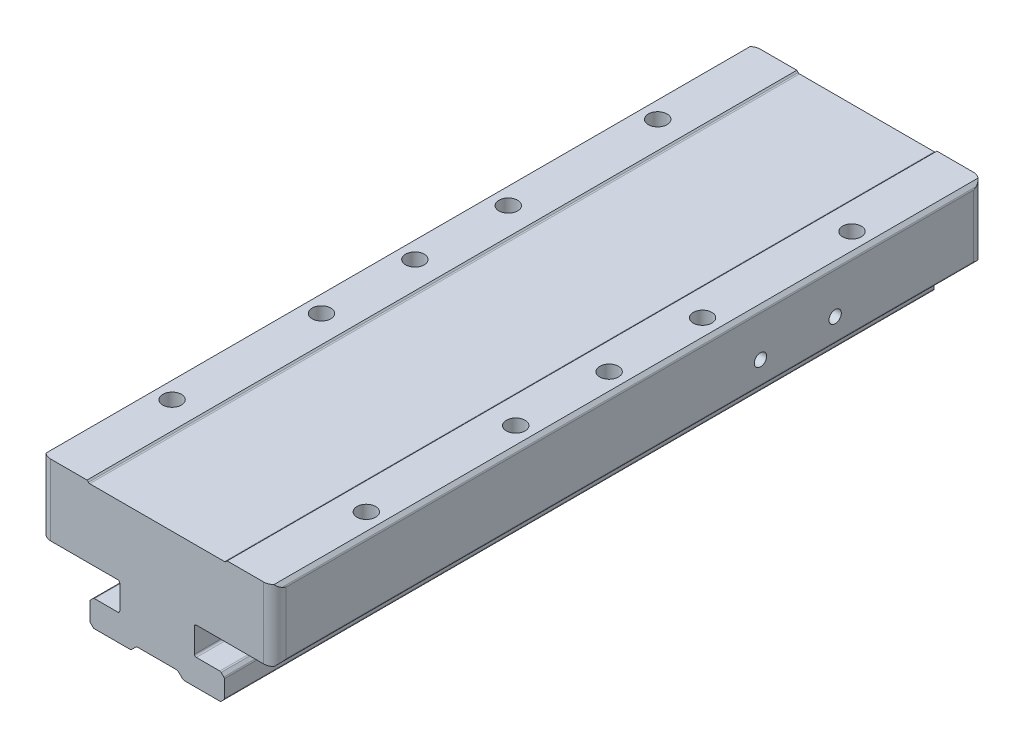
SolidWorks part; units mm, degrees
ref_plane "前视基准面" through (0, 0, 0) normal (0, 0, 1) x (1, 0, 0)
ref_plane "上视基准面" through (0, 0, 0) normal (0, 1, 0) x (1, 0, 0)
ref_plane "右视基准面" through (0, 0, 0) normal (1, 0, 0) x (0, 0, -1)
sketch "草图1" plane through (0, 0, 0) normal (0, 0, 1) x (1, 0, 0)
  line L4 (18.0429, 31.5) -> (-18.0429, 31.5)
  line L5 (-18.3964, 31.6464) -> (-19.6036, 32.8536)
  line L6 (-19.9571, 33) -> (-29.2929, 33)
  line L7 (-29.6464, 32.8536) -> (-31.3536, 31.1464)
  line L8 (-31.5, 30.7929) -> (-31.5, 14.2071)
  line L9 (-31.3536, 13.8536) -> (-30.6464, 13.1464)
  line L10 (-30.2929, 13) -> (-10.5, 13)
  line L11 (-10, 12.5) -> (-10, 6)
  line L12 (-10.5, 5.5) -> (-16.7929, 5.5)
  line L13 (-17.1464, 5.3536) -> (-17.8536, 4.6464)
  line L14 (-18, 4.2929) -> (-18, -0.2929)
  line L15 (-17.8536, -0.6464) -> (-17.1464, -1.3536)
  line L16 (-16.7929, -1.5) -> (-7.4142, -1.5)
  line L17 (-6.7071, -1.2071) -> (-5.7929, -0.2929)
  line L18 (-5.0858, 0) -> (5.0858, 0)
  line L19 (5.7929, -0.2929) -> (6.7071, -1.2071)
  line L20 (7.4142, -1.5) -> (16.7929, -1.5)
  line L21 (17.1464, -1.3536) -> (17.8536, -0.6464)
  line L22 (18, -0.2929) -> (18, 4.2929)
  line L23 (17.8536, 4.6464) -> (17.1464, 5.3536)
  line L24 (16.7929, 5.5) -> (10.5, 5.5)
  line L25 (10, 6) -> (10, 12.5)
  line L26 (10.5, 13) -> (30.2929, 13)
  line L27 (30.6464, 13.1464) -> (31.3536, 13.8536)
  line L28 (31.5, 14.2071) -> (31.5, 30.7929)
  line L29 (31.3536, 31.1464) -> (29.6464, 32.8536)
  line L30 (29.2929, 33) -> (19.9571, 33)
  line L31 (19.6036, 32.8536) -> (18.3964, 31.6464)
  arc A4 (-18.3964, 31.6464) -> (-18.0429, 31.5) centre (-18.0429, 32) ccw
  arc A5 (-19.6036, 32.8536) -> (-19.9571, 33) centre (-19.9571, 32.5) ccw
  arc A6 (-29.2929, 33) -> (-29.6464, 32.8536) centre (-29.2929, 32.5) ccw
  arc A7 (-31.3536, 31.1464) -> (-31.5, 30.7929) centre (-31, 30.7929) ccw
  arc A8 (-31.5, 14.2071) -> (-31.3536, 13.8536) centre (-31, 14.2071) ccw
  arc A9 (-30.6464, 13.1464) -> (-30.2929, 13) centre (-30.2929, 13.5) ccw
  arc A10 (-10, 12.5) -> (-10.5, 13) centre (-10.5, 12.5) ccw
  arc A11 (-10.5, 5.5) -> (-10, 6) centre (-10.5, 6) ccw
  arc A12 (-16.7929, 5.5) -> (-17.1464, 5.3536) centre (-16.7929, 5) ccw
  arc A13 (-17.8536, 4.6464) -> (-18, 4.2929) centre (-17.5, 4.2929) ccw
  arc A14 (-18, -0.2929) -> (-17.8536, -0.6464) centre (-17.5, -0.2929) ccw
  arc A15 (-17.1464, -1.3536) -> (-16.7929, -1.5) centre (-16.7929, -1) ccw
  arc A16 (-7.4142, -1.5) -> (-6.7071, -1.2071) centre (-7.4142, -0.5) ccw
  arc A17 (-5.0858, 0) -> (-5.7929, -0.2929) centre (-5.0858, -1) ccw
  arc A18 (5.7929, -0.2929) -> (5.0858, 0) centre (5.0858, -1) ccw
  arc A19 (6.7071, -1.2071) -> (7.4142, -1.5) centre (7.4142, -0.5) ccw
  arc A20 (16.7929, -1.5) -> (17.1464, -1.3536) centre (16.7929, -1) ccw
  arc A21 (17.8536, -0.6464) -> (18, -0.2929) centre (17.5, -0.2929) ccw
  arc A22 (18, 4.2929) -> (17.8536, 4.6464) centre (17.5, 4.2929) ccw
  arc A23 (17.1464, 5.3536) -> (16.7929, 5.5) centre (16.7929, 5) ccw
  arc A24 (10, 6) -> (10.5, 5.5) centre (10.5, 6) ccw
  arc A25 (10.5, 13) -> (10, 12.5) centre (10.5, 12.5) ccw
  arc A26 (30.2929, 13) -> (30.6464, 13.1464) centre (30.2929, 13.5) ccw
  arc A27 (31.3536, 13.8536) -> (31.5, 14.2071) centre (31, 14.2071) ccw
  arc A28 (31.5, 30.7929) -> (31.3536, 31.1464) centre (31, 30.7929) ccw
  arc A29 (29.6464, 32.8536) -> (29.2929, 33) centre (29.2929, 32.5) ccw
  arc A30 (19.9571, 33) -> (19.6036, 32.8536) centre (19.9571, 32.5) ccw
  arc A31 (18.0429, 31.5) -> (18.3964, 31.6464) centre (18.0429, 32) ccw
  point P99 (31.5, 29.0363)
  point P100 (-31.5, 29.0363)
  dimension "D1" = 63
extrude "凸台-拉伸1" add sketch "草图1" along normal blind 190
sketch "草图3" plane through (0, 0, 0) normal (0, 0, -1) x (-1, 0, 0)
  line L1 (0, 0) -> (0, 48.184) construction
  line L6 (-29.2929, 33) -> (-19.9571, 33) construction
  line L7 (-50, 33) -> (50, 33)
  line L8 (-50, 33) -> (-50, 32)
  line L9 (-50, 32) -> (50, 32)
  line L10 (50, 33) -> (50, 32)
  dimension "D1" = 100
  dimension "D3" = 1
extrude "切除-拉伸1" cut sketch "草图3" against normal through all
ref_plane "基准面1" through (0, 0, 95) normal (0, 0, -1) x (-1, 0, 0)
hole_wizard "M6 螺纹孔1" positions "草图43" profile "草图44" tap size "M6" standard "GB"
sketch "草图43" plane through (0, 32, 0) normal (0, 1, 0) x (1, 0, 0)
  line L0 (0, 0) -> (0, -208.4222) construction
  line L2 (31.5, -95) -> (-56.5631, -95) construction
  line L4 (17.875, -95) -> (-17.875, -95) construction
  line L5 (31.5, -190) -> (31.5, 0) construction
  point P0 (26, -70)
  point P2 (26, -120)
  point P4 (26, -160)
  point P6 (26, -30)
  point P23 (-26, -30)
  point P24 (-26, -160)
  point P25 (-26, -120)
  point P26 (-26, -70)
  dimension "D1" = 50
  dimension "D2" = 130
  dimension "D3" = 52
sketch "草图44" plane through (26, 32, 70) normal (1, 0, 0) x (0, 0, 1)
  line L0 (0, 0) -> (0, 16.5022)
  line L1 (0, 16.5022) -> (2.5, 15)
  line L2 (2.5, 15) -> (2.5, 0)
  line L5 (2.5, 0) -> (0, 0)
  line L10 (0, 16.5022) -> (-2.5, 15) construction
  line L11 (0, -6.35) -> (0, 107.95) construction
  dimension "螺纹孔钻头直径" = 5
  dimension "螺纹孔钻头深度" = 15
  dimension "导头角度" = 118
hole_wizard "大小mm 暗销孔1" positions "草图45" profile "草图46" hole size "Ø5.0" standard "GB"
sketch "草图45" plane through (0, 32, 0) normal (0, 1, 0) x (1, 0, 0)
  line L0 (17.875, -95) -> (-17.875, -95) construction
  line L1 (26, -120) -> (26, -70) construction
  line L3 (-26, -70) -> (-26, -120) construction
  point P0 (26, -95)
  point P4 (-26, -95)
sketch "草图46" plane through (26, 32, 95) normal (1, 0, 0) x (0, 0, 1)
  line L0 (0, 0) -> (0, 16.5022)
  line L1 (0, 16.5022) -> (2.5, 15)
  line L2 (2.5, 15) -> (2.5, 0)
  line L5 (2.5, 0) -> (0, 0)
  line L10 (0, 16.5022) -> (-2.5, 15) construction
  line L11 (0, -6.35) -> (0, 107.95) construction
  dimension "孔直径" = 5
  dimension "孔深度" = 15
  dimension "导头角度" = 118
other "冻结***"
hole_wizard "M4 螺纹孔4" positions "草图51" profile "草图52" tap size "M4" standard "GB"
sketch "草图51" plane through (-31.5, 0, 0) normal (-1, 0, 0) x (0, 0, 1)
  line L0 (50, 32) -> (50, -28.3918) construction
  line L1 (190, 32) -> (0, 32) construction
  line L2 (0, 30.7929) -> (0, 14.2071) construction
  line L3 (190, 32) -> (0, 32) construction
  point P0 (40, 20)
  point P2 (60, 20)
  dimension "D1" = 20
  dimension "D2" = 12
  dimension "D3" = 50
sketch "草图52" plane through (-31.5, 20, 40) normal (0, 1, 0) x (0, 0, 1)
  line L0 (0, 0) -> (0, 11.0914)
  line L1 (0, 11.0914) -> (1.65, 10.1)
  line L2 (1.65, 10.1) -> (1.65, 0)
  line L5 (1.65, 0) -> (0, 0)
  line L10 (0, 11.0914) -> (-1.65, 10.1) construction
  line L11 (0, -6.35) -> (0, 107.95) construction
  dimension "螺纹孔钻头直径" = 3.3
  dimension "螺纹孔钻头深度" = 10.1
  dimension "导头角度" = 118
mirror "镜向1" about plane through (0, 0, 0) normal (1, 0, 0) of "M4 螺纹孔4"
fillet "圆角1" radius 3 4 edges at (31.5, 22.5, 190) (-31.5, 22.5, 190) (-31.5, 22.5, 0) (31.5, 22.5, 0)
hole_wizard "M5 螺纹孔1" positions "草图53" profile "草图54" tap size "M5" standard "GB"
sketch "草图53" plane through (-31.5, 0, 0) normal (-1, 0, 0) x (0, 0, 1)
  line L0 (95, 32) -> (95, -11.6961) construction
  line L1 (189.2361, 32) -> (0.7639, 32) construction
  point P0 (95, 18)
  point P9 (95, 17.3725)
  dimension "D1" = 14
sketch "草图54" plane through (-31.5, 18, 95) normal (0, 1, 0) x (0, 0, 1)
  line L0 (0, 0) -> (0, 13.6618)
  line L1 (0, 13.6618) -> (2.1, 12.4)
  line L2 (2.1, 12.4) -> (2.1, 0)
  line L5 (2.1, 0) -> (0, 0)
  line L10 (0, 13.6618) -> (-2.1, 12.4) construction
  line L11 (0, -6.35) -> (0, 107.95) construction
  dimension "螺纹孔钻头直径" = 4.2
  dimension "螺纹孔钻头深度" = 12.4
  dimension "导头角度" = 118
